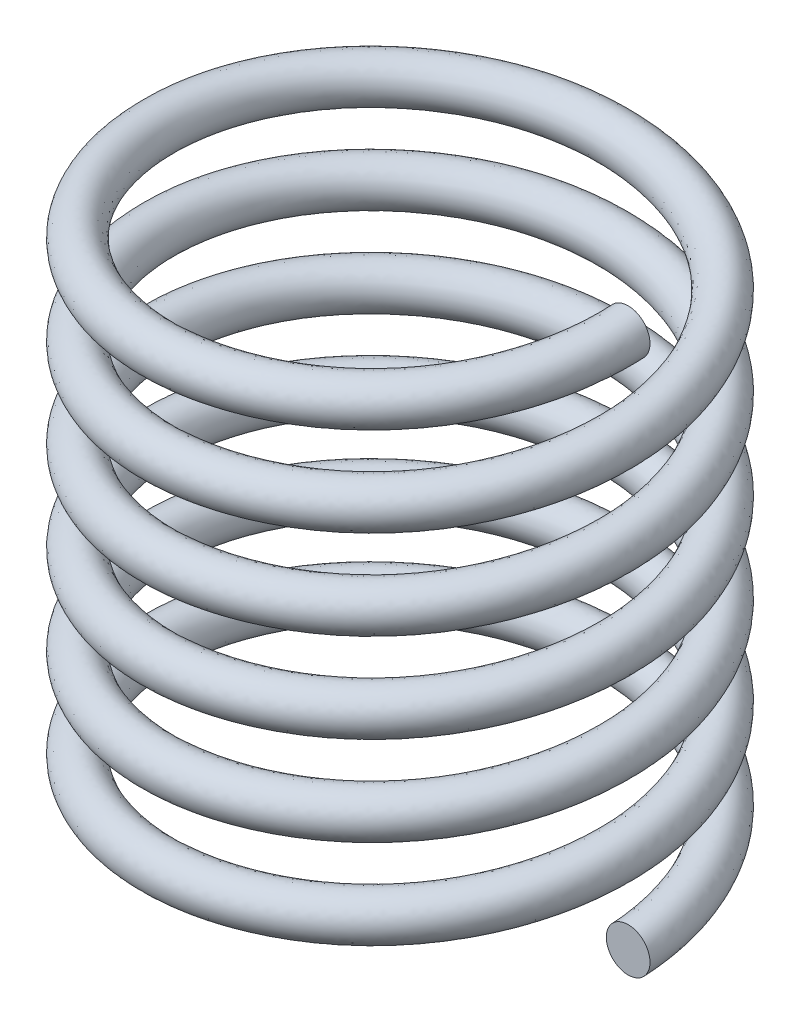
SolidWorks part; units mm, degrees
ref_plane "Front Plane" through (0, 0, 0) normal (0, 0, 1) x (1, 0, 0)
ref_plane "Top Plane" through (0, 0, 0) normal (0, 1, 0) x (1, 0, 0)
ref_plane "Right Plane" through (0, 0, 0) normal (1, 0, 0) x (0, 0, -1)
sketch "Sketch1" plane through (0, 0, 0) normal (0, 0, 1) x (1, 0, 0)
  line L0 (0, 0) -> (0, -11.0408)
  line L3 (85.9105, -1.9219) -> (71.8794, -3.4112) construction
  point P3 (0, 0)
  point P4 (0, 17.6013)
  point P5 (0, 0)
  point P6 (0, 0)
  point P7 (0, 32.8114)
sketch "Sketch2" plane through (0, 0, 0) normal (0, 0, 1) x (1, 0, 0)
  line L0 (0, 0) -> (4.7, 0) construction
  circle A0 centre (4.7, 0) radius 0.45
  dimension "D1" = 0.9
  dimension "D2" = 4.7
sweep "Sweep1" add profiles "Sketch2" path "Sketch1" parameters "D4"=2160
